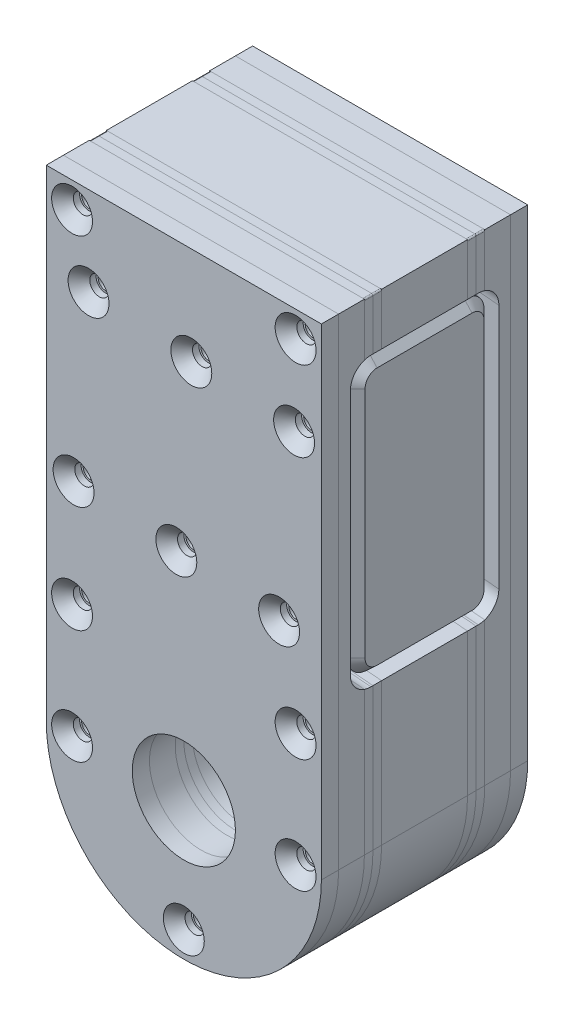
SolidWorks part; units mm, degrees
ref_plane "Front Plane" through (0, 0, 0) normal (0, 0, 1) x (1, 0, 0)
ref_plane "Top Plane" through (0, 0, 0) normal (0, 1, 0) x (1, 0, 0)
ref_plane "Right Plane" through (0, 0, 0) normal (1, 0, 0) x (0, 0, -1)
sketch "Sketch1" plane through (0, 0, 0) normal (0, 0, 1) x (1, 0, 0)
  line L2 (-25.4, -44.45) -> (-25.4, 44.45)
  line L3 (-25.4, 44.45) -> (25.4, 44.45)
  line L4 (25.4, -44.45) -> (25.4, 44.45)
  line L5 (-25.4, -44.45) -> (25.4, 44.45) construction
  line L6 (-25.4, 44.45) -> (25.4, -44.45) construction
  arc A0 (25.4, -44.45) -> (-25.4, -44.45) centre (0, -44.45) cw
  circle A1 centre (0, -44.45) radius 9.525
  point P0 (0, 0)
  dimension "D3" = 19.05
  dimension "D4" = 25.4
  dimension "D1" = 50.8
  dimension "D2" = 88.9
extrude "Boss-Extrude1" add sketch "Sketch1" along normal mid plane 31.75
ref_plane "Plane1" through (21.3477, -1.8677, 0) normal (0.9962, -0.0872, 0) x (0, 0, -1)
sketch "Sketch2" plane through (21.3477, -1.8677, 0) normal (0.9962, -0.0872, 0) x (0, 0, -1)
  line L0 (13.716, 10.5536) -> (-13.716, 10.5536) construction
  line L1 (-13.716, -15.8624) -> (13.716, -15.8624)
  line L2 (-13.716, -15.8624) -> (-13.716, 36.9696)
  line L3 (-13.716, 36.9696) -> (13.716, 36.9696)
  line L4 (13.716, -15.8624) -> (13.716, 36.9696)
  line L5 (0, -15.8624) -> (0, 36.9696) construction
  line L6 (-12.1285, 35.3821) -> (12.1285, 35.3821)
  line L7 (-12.1285, 35.3821) -> (-12.1285, -14.2749)
  line L8 (-12.1285, -14.2749) -> (12.1285, -14.2749)
  line L9 (12.1285, 35.3821) -> (12.1285, -14.2749)
  line L10 (-15.875, 46.4946) -> (15.875, 46.4946) construction
  point P12 (-12.1285, 10.5536)
  point P13 (0, 35.3821)
  point P16 (0, 10.5536)
  dimension "D1" = 52.832
  dimension "D2" = 27.432
  dimension "D3" = 24.257
  dimension "D4" = 49.657
  dimension "D5" = 9.525
extrude "Cut-Extrude1" cut sketch "Sketch2" against normal through all both and the other way through all
fillet "Fillet1" radius 3.81 4 edges at (0, -15.923, 13.716) (0, 37.1108, -13.716) (0, 37.1108, 13.716) (0, -15.923, -13.716)
sketch "Sketch8" plane through (21.3477, -1.8677, 0) normal (0.9962, -0.0872, 0) x (0, 0, -1)
  line L0 (13.716, 33.1596) -> (13.716, -12.0524) construction
  line L1 (-9.906, 36.9696) -> (9.906, 36.9696) construction
  line L12 (-12.573, 32.0166) -> (-12.573, -10.9094)
  line L13 (-8.763, -14.7194) -> (8.763, -14.7194)
  line L14 (12.573, -10.9094) -> (12.573, 32.0166)
  line L15 (8.763, 35.8266) -> (-8.763, 35.8266)
  arc A12 (-12.573, -10.9094) -> (-8.763, -14.7194) centre (-8.763, -10.9094) ccw
  arc A13 (8.763, -14.7194) -> (12.573, -10.9094) centre (8.763, -10.9094) ccw
  arc A14 (12.573, 32.0166) -> (8.763, 35.8266) centre (8.763, 32.0166) ccw
  arc A15 (-8.763, 35.8266) -> (-12.573, 32.0166) centre (-8.763, 32.0166) ccw
  point P2 (13.716, 10.5536)
  point P3 (12.573, 10.5536)
  point P6 (0, 36.9696)
  point P7 (0, 35.8266)
  dimension "D1" = 3.81
  dimension "D2" = 25.146
  dimension "D3" = 50.546
extrude "Boss-Extrude3" add sketch "Sketch8" along normal up to surface and the other way up to surface separate body
sketch "Sketch3" plane through (0, 0, -15.875) normal (0, 0, -1) x (-1, 0, 0)
  line L0 (-20.6375, -44.45) -> (20.6375, -44.45) construction
  line L1 (-25.4, 44.45) -> (25.4, 44.45) construction
  line L3 (-20.6375, 39.6875) -> (20.6375, 39.6875) construction
  circle A0 centre (-20.6375, 39.6875) radius 1.397
  circle A1 centre (20.6375, 39.6875) radius 1.397
  circle A6 centre (-20.6375, -23.4156) radius 1.397
  circle A7 centre (20.6375, -23.4156) radius 1.397
  circle A8 centre (-20.6375, -44.45) radius 1.397
  circle A9 centre (20.6375, -44.45) radius 1.397
  circle A10 centre (0, -44.45) radius 9.525 construction
  circle A13 centre (-20.6375, 18.6531) radius 1.397
  circle A14 centre (-20.6375, -2.3812) radius 1.397
  circle A17 centre (0, -65.0875) radius 1.397
  circle A18 centre (20.6375, -44.45) radius 1.397
  circle A19 centre (0, -23.8125) radius 1.397
  circle A20 centre (20.6375, 18.6531) radius 1.397
  circle A21 centre (20.6375, -2.3812) radius 1.397
  point P2 (0, -44.45)
  point P7 (0, 44.45)
  point P8 (0, 39.6875)
  point P36 (0, -44.45)
  dimension "D1" = 2
  dimension "D6" = 2.794
  dimension "D3" = 41.275
  dimension "D4" = 4
  dimension "D5" = 4.7625
  dimension "D2" = 5
extrude "Cut-Extrude2" cut sketch "Sketch3" against normal through all
sketch "Sketch4" plane through (0, 0, 0) normal (0, 0, 1) x (1, 0, 0)
  line L1 (25.4, -16.9978) -> (25.4, 33.7412) construction
  line L2 (-25.4, -12.5534) -> (-25.4, 38.1857) construction
  line L3 (25.4, 8.3717) -> (-25.4, 12.8161) construction
  line L5 (-1.3836, -5.2207) -> (1.3836, 26.4085) construction
  circle A0 centre (20.3611, 24.7482) radius 1.397
  circle A1 centre (1.3836, 26.4085) radius 1.397
  circle A2 centre (-1.3836, -5.2207) radius 1.397
  circle A3 centre (17.5939, -6.881) radius 1.397
  circle A4 centre (-17.5939, 28.0688) radius 1.397
  circle A5 centre (-20.3611, -3.5604) radius 1.397
  point P3 (0, 10.5939)
  point P4 (0, 10.5939)
  dimension "D1" = 3
  dimension "D7" = 2.794
  dimension "D3" = 31.75
  dimension "D6" = 19.05
  dimension "D2" = 2
extrude "Cut-Extrude3" cut sketch "Sketch4" against normal through all both and the other way through all
sketch "Sketch7" plane through (0, 0, 15.875) normal (0, 0, 1) x (1, 0, 0)
  line L3 (25.4, -44.45) -> (25.4, 44.45)
  line L4 (25.4, 44.45) -> (-25.4, 44.45)
  line L5 (-25.4, 44.45) -> (-25.4, -44.45)
  line L6 (25.4, -44.45) -> (25.4, 44.45)
  line L7 (25.4, 44.45) -> (-25.4, 44.45)
  line L8 (-25.4, 44.45) -> (-25.4, -44.45)
  circle A0 centre (20.6375, -44.45) radius 1.397 construction
  circle A1 centre (20.6375, -23.4156) radius 1.397 construction
  circle A2 centre (17.5939, -6.881) radius 1.397 construction
  circle A3 centre (-1.3836, -5.2207) radius 1.397 construction
  circle A4 centre (20.6375, 39.6875) radius 1.397 construction
  circle A5 centre (20.3611, 24.7482) radius 1.397 construction
  circle A6 centre (1.3836, 26.4085) radius 1.397 construction
  circle A7 centre (-20.6375, 39.6875) radius 1.397 construction
  circle A10 centre (-20.6375, -23.4156) radius 1.397 construction
  circle A11 centre (0, -44.45) radius 9.525 construction
  circle A12 centre (-20.6375, -44.45) radius 1.397 construction
  circle A13 centre (20.6375, -44.45) radius 1.397
  circle A14 centre (20.6375, -23.4156) radius 1.397
  circle A15 centre (17.5939, -6.881) radius 1.397
  circle A16 centre (-1.3836, -5.2207) radius 1.397
  circle A17 centre (20.6375, 39.6875) radius 1.397
  circle A18 centre (20.3611, 24.7482) radius 1.397
  circle A19 centre (1.3836, 26.4085) radius 1.397
  circle A20 centre (-20.6375, 39.6875) radius 1.397
  circle A23 centre (-20.6375, -23.4156) radius 1.397
  circle A24 centre (0, -44.45) radius 9.525
  circle A25 centre (-20.6375, -44.45) radius 1.397
  circle A26 centre (0, -65.0875) radius 1.397 construction
  arc A27 (-25.4, -44.45) -> (25.4, -44.45) centre (0, -44.45) ccw
  arc A28 (-25.4, -44.45) -> (25.4, -44.45) centre (0, -44.45) ccw
  circle A29 centre (0, -65.0875) radius 1.397
  circle A30 centre (-20.3611, -3.5604) radius 1.397 construction
  circle A31 centre (-17.5939, 28.0688) radius 1.397 construction
  circle A32 centre (-20.3611, -3.5604) radius 1.397
  circle A33 centre (-17.5939, 28.0688) radius 1.397
  dimension "D1" = 0
extrude "Boss-Extrude2" add sketch "Sketch7" along normal blind 3.175 separate body
chamfer "Chamfer1" distance 2.3813 angle 45 13 edges at (-19.2405, 39.6875, 19.05) (22.0345, 39.6875, 19.05) (21.7581, 24.7482, 19.05) (2.7806, 26.4085, 19.05) (0.0134, -5.2207, 19.05) (18.9909, -6.881, 19.05) (22.0345, -23.4156, 19.05) (-19.2405, -23.4156, 19.05) (-19.2405, -44.45, 19.05) (22.0345, -44.45, 19.05) (1.397, -65.0875, 19.05) (-18.9641, -3.5604, 19.05) (-16.1969, 28.0688, 19.05)
mirror "Mirror2" about plane through (0, 0, 0) normal (0, 0, 1)
ref_plane "Plane2" through (0, 0, 9.525) normal (0, 0, 1) x (1, 0, 0)
ref_plane "Plane3" through (0, 0, -9.525) normal (0, 0, 1) x (1, 0, 0)
ref_plane "Plane4" through (0, 0, 11.1125) normal (0, 0, 1) x (1, 0, 0)
ref_plane "Plane5" through (0, 0, 7.9375) normal (0, 0, 1) x (1, 0, 0)
ref_plane "Plane6" through (0, 0, -7.9375) normal (0, 0, 1) x (1, 0, 0)
ref_plane "Plane7" through (0, 0, -11.1125) normal (0, 0, 1) x (1, 0, 0)
split "Split1" trim tools "Plane2", "Plane3", "Plane4", "Plane5", "Plane6", "Plane7" bodies to split 104 107 106 109 123 resulting bodies 114 117 136 137 138 139 140 141 142 143 144 145
fillet "Fillet2" radius 0.254 2 edges at (-25.4, 44.45, 10.3188) (25.4, 44.45, 10.3188)
fillet "Fillet3" radius 0.254 2 edges at (-25.4, 44.45, 8.7312) (25.4, 44.45, 8.7312)
fillet "Fillet4" radius 0.254 2 edges at (-25.4, 44.45, -8.7312) (25.4, 44.45, -8.7312)
fillet "Fillet5" radius 0.254 2 edges at (-25.4, 44.45, -10.3187) (25.4, 44.45, -10.3187)
chamfer "Chamfer2" distance 1.5875 angle 45 16 edges at (-25.4, 12.8161, 12.573) (-25.4, 37.0655, 11.4571) (-25.4, -11.4332, 11.4571) (-25.4, 38.1857, 0) (-25.4, -12.5534, 0) (-25.4, 37.0655, -11.4571) (-25.4, -11.4332, -11.4571) (-25.4, 12.8161, -12.573) (25.4, 8.3717, 12.573) (25.4, 32.6211, 11.4571) (25.4, -15.8776, 11.4571) (25.4, 33.7412, 0) (25.4, -16.9978, 0) (25.4, 32.6211, -11.4571) (25.4, -15.8776, -11.4571) (25.4, 8.3717, -12.573)
sketch "Sketch9" plane through (0, 0, 19.05) normal (0, 0, 1) x (1, 0, 0)
  circle A0 centre (-20.6375, -44.45) radius 1.397 construction
  circle A1 centre (0, -65.0875) radius 1.397 construction
  circle A2 centre (20.6375, -44.45) radius 1.397 construction
  circle A3 centre (20.6375, -23.4156) radius 1.397 construction
  circle A4 centre (-20.6375, -23.4156) radius 1.397 construction
  circle A5 centre (-20.3611, -3.5604) radius 1.397 construction
  circle A6 centre (-1.3836, -5.2207) radius 1.397 construction
  circle A7 centre (17.5939, -6.881) radius 1.397 construction
  circle A8 centre (20.3611, 24.7482) radius 1.397 construction
  circle A9 centre (20.6375, 39.6875) radius 1.397 construction
  circle A10 centre (1.3836, 26.4085) radius 1.397 construction
  circle A11 centre (-17.5939, 28.0688) radius 1.397 construction
  circle A12 centre (-20.6375, 39.6875) radius 1.397 construction
  circle A13 centre (-20.6375, -44.45) radius 1.397
  circle A14 centre (0, -65.0875) radius 1.397
  circle A15 centre (20.6375, -44.45) radius 1.397
  circle A16 centre (20.6375, -23.4156) radius 1.397
  circle A17 centre (-20.6375, -23.4156) radius 1.397
  circle A18 centre (-20.3611, -3.5604) radius 1.397
  circle A19 centre (-1.3836, -5.2207) radius 1.397
  circle A20 centre (17.5939, -6.881) radius 1.397
  circle A21 centre (20.3611, 24.7482) radius 1.397
  circle A22 centre (20.6375, 39.6875) radius 1.397
  circle A23 centre (1.3836, 26.4085) radius 1.397
  circle A24 centre (-17.5939, 28.0688) radius 1.397
  circle A25 centre (-20.6375, 39.6875) radius 1.397
extrude "Cut-Extrude-Thin1" cut sketch "Sketch9" against normal through all thin
